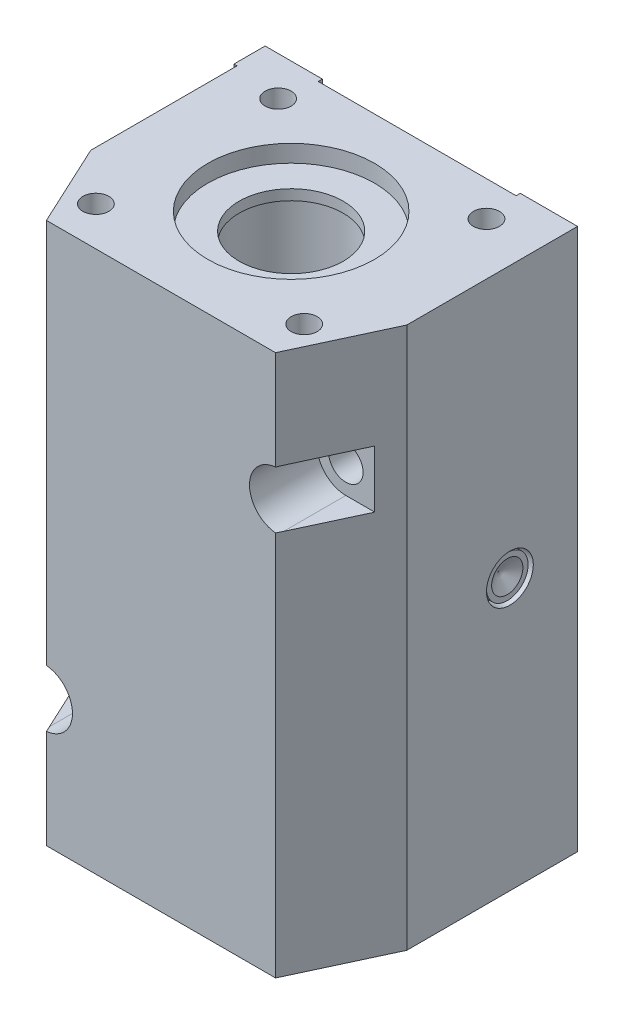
SolidWorks part; units mm, degrees
ref_plane "Plan de face" through (0, 0, 0) normal (0, 0, 1) x (1, 0, 0)
ref_plane "Plan de dessus" through (0, 0, 0) normal (0, 1, 0) x (1, 0, 0)
ref_plane "Plan de droite" through (0, 0, 0) normal (1, 0, 0) x (0, 0, -1)
imported_body " Importée1"
sketch "Esquisse1" plane through (0, 0, -24.2) normal (0, 0, -1) x (-1, 0, 0)
  line L0 (-19, -52) -> (-30, -52)
  line L1 (-30, -52) -> (-30, 52)
  line L2 (-30, 52) -> (-19, 52)
  line L3 (-19, 52) -> (-19, -52)
extrude "Extrusion1" add sketch "Esquisse1" along normal blind 0.8
sketch "Esquisse2" plane through (-29.4, 0, 0) normal (-1, 0, 0) x (0, 0, 1)
  line L0 (-25, 52) -> (-19, 52)
  line L1 (-19, 52) -> (-19, -52)
  line L2 (-19, -52) -> (-25, -52)
  line L3 (-25, -52) -> (-25, 52)
extrude "Extrusion2" add sketch "Esquisse2" along normal blind 0.6
hole_wizard "Perçage1" positions "Esquisse4" profile "Esquisse3" legacy
sketch "Esquisse4" plane through (0, 0, 12) normal (0, 0, 1) x (1, 0, 0)
  point P0 (-22.5, -27.5)
sketch "Esquisse3" plane through (-22.5, -27.5, 12) normal (1, 0, 0) x (0, -1, 0)
  line L0 (0, 0) -> (0, 19.001)
  line L1 (0, 19.001) -> (3.3, 19.001)
  line L2 (3.3, 19.001) -> (3.3, 0)
  line L3 (3.3, 0) -> (0, 0)
  line L4 (0, 110) -> (0, -10) construction
  dimension "Diamètre" = 6.6
  dimension "Profondeur" = 19.001
ref_plane "Plan1" through (0, 46.7, 0) normal (0, 1, 0) x (-1, 0, 0)
sketch "Esquisse5" plane through (0, 46.7, 0) normal (0, 1, 0) x (-1, 0, 0)
  circle A0 centre (0, 0) radius 10.5
extrude "Enlèv. mat.-Extru.1" cut sketch "Esquisse5" against normal blind 41
ref_plane "Plan2" through (0, 41.799, 0) normal (0, 1, 0) x (-1, 0, 0)
ref_plane "Plan3" through (0, -5.7, 0) normal (0, 1, 0) x (-1, 0, 0)
sketch "Esquisse12" plane through (0, -5.7, 0) normal (0, 1, 0) x (-1, 0, 0)
  circle A0 centre (0, 0) radius 10.5
extrude "Enlèv. mat.-Extru.2" cut sketch "Esquisse12" against normal blind 41
ref_plane "Plan4" through (0, -10.601, 0) normal (0, 1, 0) x (-1, 0, 0)
ref_plane "Plan5" through (0, -41.799, 0) normal (0, -1, 0) x (1, 0, 0)
hole_wizard "Perçage2" positions "Esquisse20" profile "Esquisse19" legacy
sketch "Esquisse20" plane through (30, 0, 0) normal (1, 0, 0) x (0, 0, -1)
  point P0 (12, 0)
sketch "Esquisse19" plane through (30, 0, -12) normal (0, 1, 0) x (0, 0, -1)
  line L0 (0, 0) -> (0, 2.5)
  line L1 (0, 2.5) -> (4.5, 2.5)
  line L2 (4.5, 2.5) -> (4.5, 0)
  line L3 (4.5, 0) -> (0, 0)
  line L4 (0, 110) -> (0, -10) construction
  dimension "Diamètre" = 9
  dimension "Profondeur" = 2.5
sketch "Esquisse21" plane through (0, 0, 0) normal (0, 0, 1) x (1, 0, 0)
  line L0 (16, 52) -> (0, 52)
  line L1 (0, 52) -> (0, 46.7)
  line L2 (0, 46.7) -> (10, 46.7)
  line L3 (10, 46.7) -> (10, 48.7)
  line L4 (10, 48.7) -> (16, 48.7)
  line L5 (16, 48.7) -> (16, 52)
  line L6 (0, 52) -> (0, 46.7) construction
revolve "Enlèvement de matière-Révolution1" cut sketch "Esquisse21" angle 360 about L6
ref_plane "Plan6" through (-6.3778, 11.5395, 0) normal (-0.4837, 0.8752, 0) x (-0.8752, -0.4837, 0)
sketch "Esquisse22" plane through (-6.3778, 11.5395, 0) normal (-0.4837, 0.8752, 0) x (-0.8752, -0.4837, 0)
  line L0 (-32.9949, -25) -> (-28.9959, -25)
  line L1 (-28.9959, -25) -> (-29.6929, -24.303)
  line L2 (-29.6929, -24.303) -> (-29.6929, -7.001)
  line L3 (-29.6929, -7.001) -> (-29.6929, 12)
  line L4 (-29.6929, 12) -> (-32.9949, 12)
  line L5 (-32.9949, 12) -> (-32.9949, -25)
  line L6 (-32.9949, 12) -> (-32.9949, -25) construction
revolve "Enlèvement de matière-Révolution2" cut sketch "Esquisse22" angle 360 about L6
ref_plane "Plan7" through (0, 0, -12) normal (0, 0, 1) x (1, 0, 0)
sketch "Esquisse23" plane through (0, 0, -12) normal (0, 0, 1) x (1, 0, 0)
  line L0 (27.5, 4) -> (27.5, 0)
  line L1 (27.5, 0) -> (29.5, 0)
  line L2 (29.5, 0) -> (29.5, 4)
  line L3 (29.5, 4) -> (27.5, 4)
  line L4 (27.5, 0) -> (29.5, 0) construction
revolve "Révolution1" add sketch "Esquisse23" angle 360 about L4
ref_plane "Plan8" through (0, 0, -12) normal (0, 0, -1) x (-1, 0, 0)
sketch "Esquisse24" plane through (0, 0, -12) normal (0, 0, -1) x (-1, 0, 0)
  line L0 (-29.5, 3) -> (-29.5, 0)
  line L1 (-29.5, 0) -> (-27.7679, 0)
  line L2 (-27.7679, 0) -> (-29.5, 3)
  line L3 (-29.5, 0) -> (-27.7678, 0) construction
revolve "Enlèvement de matière-Révolution3" cut sketch "Esquisse24" angle 360 about L3
sketch "Esquisse25" plane through (0, 0, 0) normal (0, 0, 1) x (1, 0, 0)
  line L0 (10, 5.7) -> (0, 5.7)
  line L1 (0, 5.7) -> (0, -5.7)
  line L2 (0, -5.7) -> (10, -5.7)
  line L3 (10, -5.7) -> (10, -3.7)
  line L4 (10, -3.7) -> (16, -3.7)
  line L5 (16, -3.7) -> (16, 3.7)
  line L6 (16, 3.7) -> (10, 3.7)
  line L7 (10, 3.7) -> (10, 5.7)
  line L8 (0, 5.7) -> (0, -5.7) construction
revolve "Enlèvement de matière-Révolution4" cut sketch "Esquisse25" angle 360 about L8
hole_wizard "Perçage3" positions "Esquisse27" profile "Esquisse26" legacy
sketch "Esquisse27" plane through (0, -52, 0) normal (0, -1, 0) x (1, 0, 0)
  point P0 (0, 0)
sketch "Esquisse26" plane through (0, -52, 0) normal (1, 0, 0) x (0, 0, -1)
  line L0 (0, 0) -> (0, 5.3)
  line L1 (0, 5.3) -> (10, 5.3)
  line L2 (10, 5.3) -> (10, 3.3)
  line L3 (10, 3.3) -> (16, 3.3)
  line L4 (16, 3.3) -> (16, 0)
  line L5 (16, 0) -> (0, 0)
  line L6 (0, 110) -> (0, -10) construction
  dimension "Diamètre" = 20
  dimension "Profondeur" = 5.3
  dimension "Diamètre chambrage" = 32
  dimension "Profondeur chambrage" = 3.3
hole_wizard "Trou taraudé M61" positions "Esquisse3D1" profile "Esquisse29" tap size "M6" standard "ISO"
sketch3d "Esquisse3D1"
  line L0 (30, 52, 7.8) -> (30, 52, -25) construction
  line L1 (19, 52, -25) -> (30, 52, -25) construction
  point P0 (20, 52, -17.5)
  point P1 (20, 52, 17.5)
  point P2 (-20, 52, 17.5)
  point P6 (-20, 52, -17.5)
  dimension "D1" = 35
  dimension "D2" = 40
  dimension "D3" = 10
  dimension "D4" = 7.5
sketch "Esquisse29" plane through (20, 52, -17.5) normal (1, 0, 0) x (0, 0, 1)
  line L0 (0, 0) -> (0, 16.5022)
  line L1 (0, 16.5022) -> (2.5, 15)
  line L2 (2.5, 15) -> (2.5, 0)
  line L5 (2.5, 0) -> (0, 0)
  line L10 (0, 16.5022) -> (-2.5, 15) construction
  line L11 (0, -6.35) -> (0, 107.95) construction
  dimension "Diamètre du trou pour taraudage" = 5
  dimension "Profondeur du trou pour taraudage" = 15
  dimension "Angle de pointe" = 118
